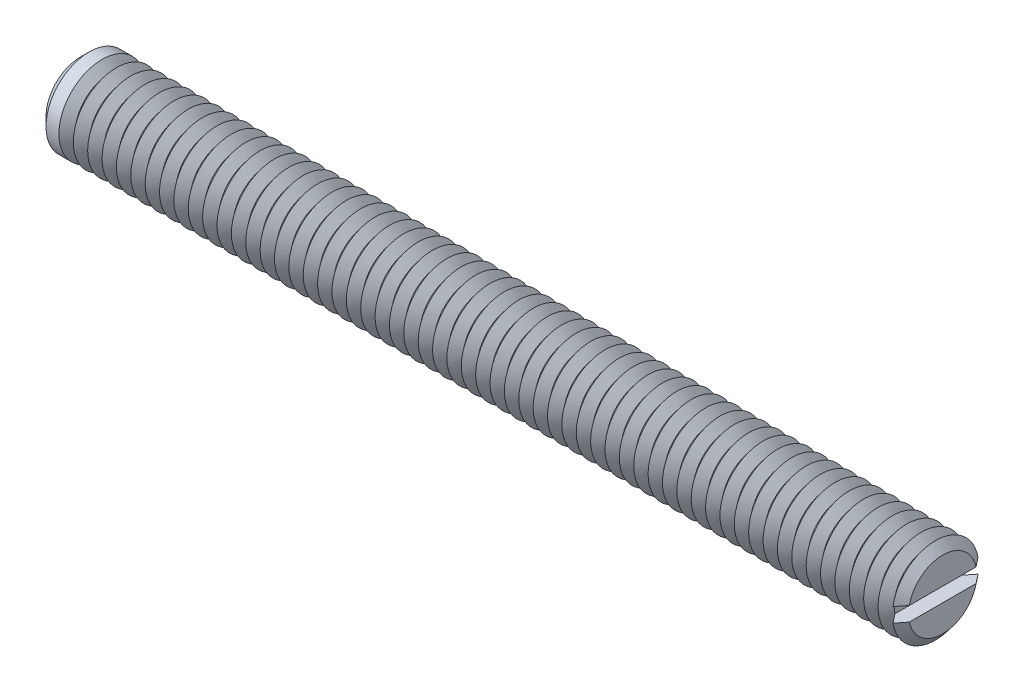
SolidWorks part; units mm, degrees
ref_plane "Front Plane" through (0, 0, 0) normal (0, 0, 1) x (1, 0, 0)
ref_plane "Top Plane" through (0, 0, 0) normal (0, 1, 0) x (1, 0, 0)
ref_plane "Right Plane" through (0, 0, 0) normal (1, 0, 0) x (0, 0, -1)
sketch "Sketch1" plane through (0, 0, 0) normal (1, 0, 0) x (0, 0, -1)
  circle A0 centre (0, 0) radius 3
  dimension "D1" = 6
extrude "Extrude1" add sketch "Sketch1" along normal mid plane 60
sketch "Sketch2" plane through (0, 0, 0) normal (0, 0, 1) x (1, 0, 0)
  line L0 (30, 0.5) -> (29, 0.5)
  line L1 (30, -3) -> (30, 3) construction
  line L2 (29, 0.5) -> (29, -0.5)
  line L3 (0, 0) -> (50000, 0) construction
  line L4 (30, -0.5) -> (29, -0.5)
  line L5 (30, -0.5) -> (30, 0.5)
  point P9 (29, 0)
  dimension "D1" = 1
extrude "Extrude2" cut sketch "Sketch2" against normal mid plane 9
chamfer "Chamfer1" distance 0.6 angle 45 1 edges at (-30, 0, -3)
sketch "Sketch3" plane through (0, 0, 0) normal (0, 0, 1) x (1, 0, 0)
  line L0 (0, 0) -> (30.9602, 0) construction
  line L1 (29.5, -3) -> (30.5, -3)
  line L2 (-29.4, -3) -> (30, -3) construction
  line L3 (30.5, -3) -> (30, -2.3755)
  line L4 (30, -3) -> (30, -0.5) construction
  line L5 (30, -2.3755) -> (29.5, -3)
  dimension "D1" = 1
  dimension "D2" = 0.8
revolve "Cut-Revolve1" cut sketch "Sketch3" angle 360 about L0
pattern_linear "LPattern1" count 59 spacing 1 along (-1, 0, 0) of "Cut-Revolve1"
equation "\"D2@Sketch3\" = \"D1@Sketch3\"*0.8"
